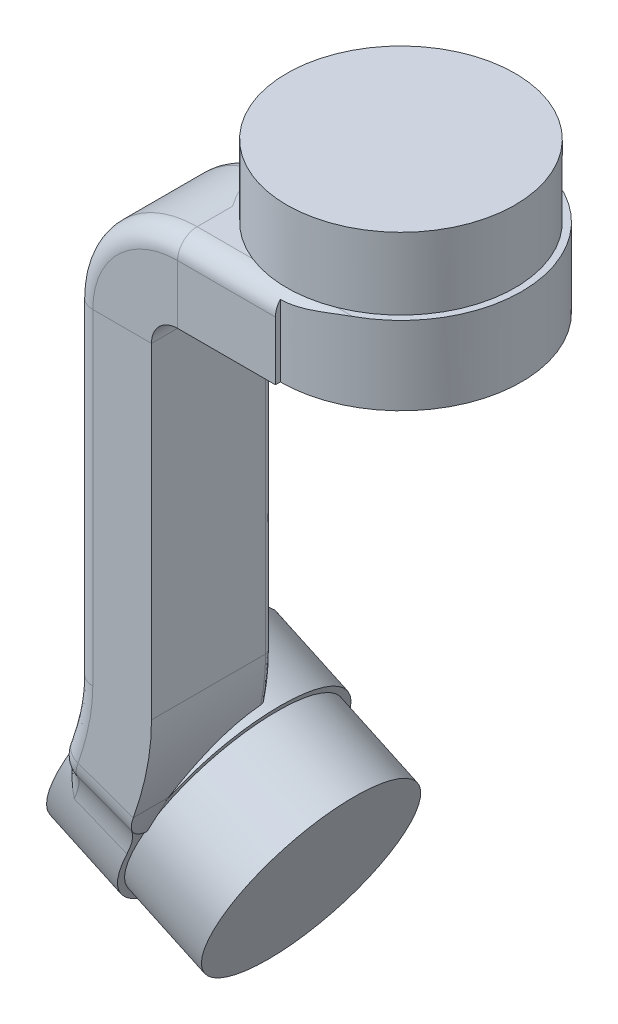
SolidWorks part; units mm, degrees
ref_plane "Plan de face" through (0, 0, 0) normal (0, 0, 1) x (1, 0, 0)
ref_plane "Plan de dessus" through (0, 0, 0) normal (0, 1, 0) x (1, 0, 0)
ref_plane "Plan de droite" through (0, 0, 0) normal (1, 0, 0) x (0, 0, -1)
sketch "Esquisse1" plane through (0, 0, 0) normal (0, 0, 1) x (1, 0, 0)
  line L0 (0, 0) -> (-32.5512, 0) construction
  line L1 (-25, 0.6881) -> (-25, -87.185) construction
  line L2 (-62.0838, -65.5054) -> (-31, -80) construction
  line L3 (-31, -80) -> (-64.3062, -80) construction
  point P6 (-25, -87.185)
  point P9 (-24.6422, -29.5768)
  point P10 (-53.4179, -63.9914)
  point P11 (0, 0)
  point P12 (-62.259, -80)
  point P13 (-28.9528, -80)
  dimension "D1" = 25
  dimension "D2" = 25
  dimension "D3" = 80
  dimension "D4" = 6
ref_plane "Plan1" through (0, 0, -10) normal (0, 0, 1) x (1, 0, 0)
sketch3d "Esquisse3D1"
  line L0 (0, 0, 0) -> (0, 0, -10) construction
  line L3 (0, 0, 0) -> (-32.5512, 0, 0) construction
  point P2 (0, 0, 0)
  point P3 (0, 0, 0)
  point P4 (-25, 0, 0)
  point P7 (0, 0, -5)
  point P8 (0, 0, 0)
  point P9 (0, 0, 0)
  dimension "D1" = 10
sketch "Esquisse4" plane through (0, 0, 0) normal (0, 1, 0) x (1, 0, 0)
  circle A0 centre (0, 10) radius 18.5
  dimension "D1" = 37
extrude "Boss.-Extru.2" add sketch "Esquisse4" along normal mid plane 12
sketch3d "Esquisse3D2"
  line L0 (-31, -80, 0) -> (-31, -80, -10) construction
  dimension "D1" = 10
ref_plane "Plan2" through (-36.1786, -77.5852, 0) normal (0.4226, 0.9063, 0) x (0.9063, -0.4226, 0)
ref_plane "Plan3" through (5.1786, -2.4148, 0) normal (0.9063, -0.4226, 0) x (0, 0, -1)
sketch "Esquisse5" plane through (0, 0, 0) normal (0, 0, 1) x (1, 0, 0)
  line L0 (0, 0) -> (-15, 0)
  line L1 (0, 0) -> (-32.5512, 0) construction
  line L2 (-25, 0.6881) -> (-25, -87.185) construction
  line L3 (-25, -10) -> (-25, -60)
  arc A4 (-22.2958, -0.5582) -> (-25, -5) centre (-20, -5) ccw
  arc A5 (-22.2958, -0.5582) -> (-25, -5) centre (-20, -5) ccw
  arc A7 (-20, 0) -> (-25, -5) centre (-20, -5) ccw
  arc A8 (-15, 0) -> (-25, -10) centre (-15, -10) ccw
  point P1 (-22.2958, -0.5582)
  point P10 (-25, 0)
  dimension "D6" = 5
  dimension "D7" = 5
  dimension "D9" = 5
  dimension "D10" = 10
  dimension "D1" = 60
sketch3d "Esquisse3D3"
  line L0 (-25, 0.6881, 0) -> (-25, -87.185, 0) construction
  spline S0 degree 2 poles (-25, -60, 0) (-25, -65.4985, 0) (-27.449, -72.3848, 0) knots 0 0 0 0.633802 0.633802 0.633802
  point P2 (0, 0, 0)
sketch "Esquisse6" plane through (5.1786, -2.4148, 0) normal (0.9063, -0.4226, 0) x (0, 0, -1)
  line L0 (0, -64.9439) -> (0, -77.2033) construction
  spline S0 degree 3 poles (0, -77.2033) (0, -81.9166) (6.1921, -85.1317) (10, -85.6058) knots 0 0 0 0 0.775392 0.775392 0.775392 0.775392
sketch "Esquisse7" plane through (0, 0, 0) normal (1, 0, 0) x (0, 0, -1)
  line L1 (9.25, 6) -> (-9.25, 6)
  line L2 (9.25, 6) -> (9.25, -6)
  line L3 (9.25, -6) -> (-9.25, -6)
  line L4 (-9.25, 6) -> (-9.25, -6)
  line L5 (9.25, 6) -> (-9.25, -6) construction
  line L6 (9.25, -6) -> (-9.25, 6) construction
  point P0 (0, 0)
  dimension "D1" = 18.5
  dimension "D2" = 12
sketch "Esquisse8" plane through (0, 0, -10) normal (0, 0, 1) x (1, 0, 0)
  line L1 (-21.75, -74) -> (-40.25, -74)
  line L2 (-21.75, -74) -> (-21.75, -86)
  line L3 (-21.75, -86) -> (-40.25, -86)
  line L4 (-40.25, -74) -> (-40.25, -86)
  line L5 (-21.75, -74) -> (-40.25, -86) construction
  line L6 (-21.75, -86) -> (-40.25, -74) construction
  point P0 (-31, -80)
  dimension "D1" = 18.5
  dimension "D2" = 12
ref_plane "Plan4" through (0, -60, 0) normal (0, 1, 0) x (1, 0, 0)
sketch "Esquisse9" plane through (0, -60, 0) normal (0, 1, 0) x (1, 0, 0)
  line L1 (-19, 9.25) -> (-31, 9.25)
  line L2 (-19, 9.25) -> (-19, -9.25)
  line L3 (-19, -9.25) -> (-31, -9.25)
  line L4 (-31, 9.25) -> (-31, -9.25)
  line L5 (-19, 9.25) -> (-31, -9.25) construction
  line L6 (-19, -9.25) -> (-31, 9.25) construction
  point P0 (-25, 0)
  dimension "D1" = 18.5
  dimension "D2" = 12
sweep "Balayage2" add profiles "Esquisse7" path "Esquisse5"
sweep "Balayage3" add profiles "Esquisse9" path "Esquisse3D3"
sketch "Esquisse10" plane through (5.1786, -2.4148, 0) normal (0.9063, -0.4226, 0) x (0, 0, -1)
  circle A0 centre (10, -85.6058) radius 16.5
  dimension "D1" = 33
extrude "Boss.-Extru.3" add sketch "Esquisse10" along normal mid plane 12
sketch "Esquisse11" plane through (-25.9337, -72.9236, 0) normal (-0.3351, -0.9422, 0) x (0.9422, -0.3351, 0)
  line L0 (-7.6082, 4.5209) -> (4.3918, 3.8491) construction
  line L1 (4.3918, 9.25) -> (4.3918, 3.8491) construction
  line L2 (-7.6082, 9.25) -> (4.3918, 9.25) construction
  line L3 (-7.6082, 4.5209) -> (-7.6082, 9.25) construction
  line L4 (4.3918, 9.25) -> (4.3918, 3.8491)
  line L5 (-7.6082, 9.25) -> (4.3918, 9.25)
  line L6 (-7.6082, 4.5209) -> (-7.6082, 9.25)
  line L7 (-7.6082, 4.5209) -> (4.3918, 3.8491)
revolve "Révolution3" add sketch "Esquisse11" angle 76 about L0
fillet "Congé1" radius 10 1 edges at (-26.5435, -77.8187, 6.0421)
fillet "Congé2" radius 3 9 edges at (-27.4851, 0.0061, -9.25) (-7.5, 6, 9.25) (-26.3137, 1.3137, 9.25) (-35.2357, -75.729, 6.8961) (-33.5991, -71.7339, 9.023) (-31, -35, -9.25) (-31, -35, 9.25)
fillet "Congé4" radius 1 3 edges at (-17.8284, -7.1716, -9.25) (-19, -35, -9.25)
sketch "Esquisse12" plane through (0, 6, 0) normal (0, 1, 0) x (1, 0, 0)
  circle A0 centre (0, 10) radius 17.5
  arc A1 (8.8424, -6.25) -> (-15, -0.8282) centre (0, 10) ccw construction
  dimension "D1" = 35
extrude "Boss.-Extru.4" add sketch "Esquisse12" along normal blind 11
sketch "Esquisse13" plane through (10.6164, -4.9505, 0) normal (0.9063, -0.4226, 0) x (0, 0, -1)
  circle A0 centre (10, -85.6058) radius 15.5
  arc A1 (-6.4997, -85.5051) -> (-4.1132, -77.0578) centre (10, -85.6058) ccw construction
  point P2 (0, 0)
  dimension "D1" = 31
extrude "Boss.-Extru.5" add sketch "Esquisse13" along normal blind 13
